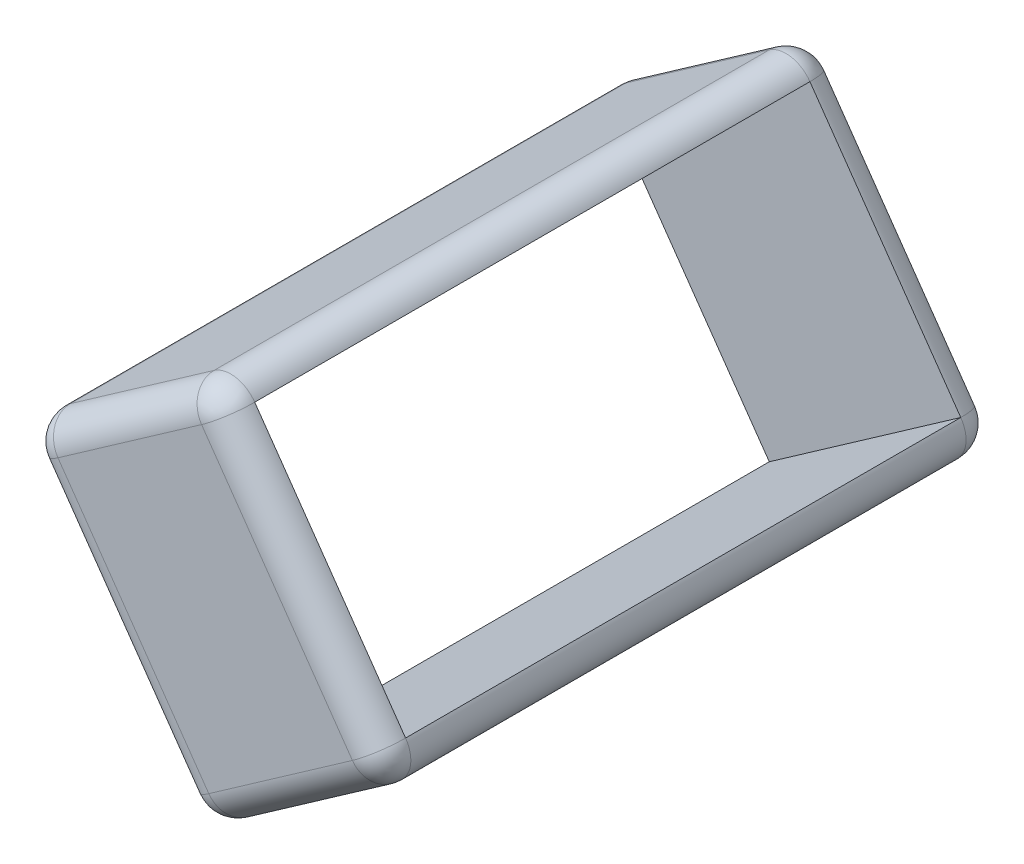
SolidWorks part; units mm, degrees
ref_plane "Front" through (0, 0, 0) normal (0, 0, 1) x (1, 0, 0)
ref_plane "Top" through (0, 0, 0) normal (0, 1, 0) x (1, 0, 0)
ref_plane "Right" through (0, 0, 0) normal (1, 0, 0) x (0, 0, -1)
sketch "Sketch1" plane through (0, 0, 0) normal (0, 0, 1) x (1, 0, 0)
  line L0 (0, -21) -> (24.6889, -56.2594) construction
  line L1 (0, -21) -> (44.9807, -21) construction
  line L2 (17.3721, -52.7838) -> (11.0628, -43.7731)
  line L3 (11.0628, -43.7731) -> (17.616, -39.1845)
  line L4 (17.616, -39.1845) -> (23.9254, -48.1952)
  line L5 (23.9254, -48.1952) -> (17.3721, -52.7838)
  circle A0 centre (0, -21) radius 35 construction
  point P5 (14.3394, -41.4788)
  dimension "D1" = 55
  dimension "D2" = 8
  dimension "D3" = 11
  dimension "D4" = 25
extrude "Base-Extrude" add sketch "Sketch1" along normal mid plane 21
fillet "Fillet1" radius 1 12 edges at (20.6488, -50.4895, 10.5) (20.7707, -43.6898, 10.5) (14.3394, -41.4788, 10.5) (20.7707, -43.6898, -10.5) (20.6488, -50.4895, -10.5) (14.2175, -48.2784, -10.5) (14.3394, -41.4788, -10.5) (14.2175, -48.2784, 10.5) (17.616, -39.1845, 0) (23.9254, -48.1952, 0) (17.3721, -52.7838, 0) (11.0628, -43.7731, 0)
shell "Shell1" thickness 1
